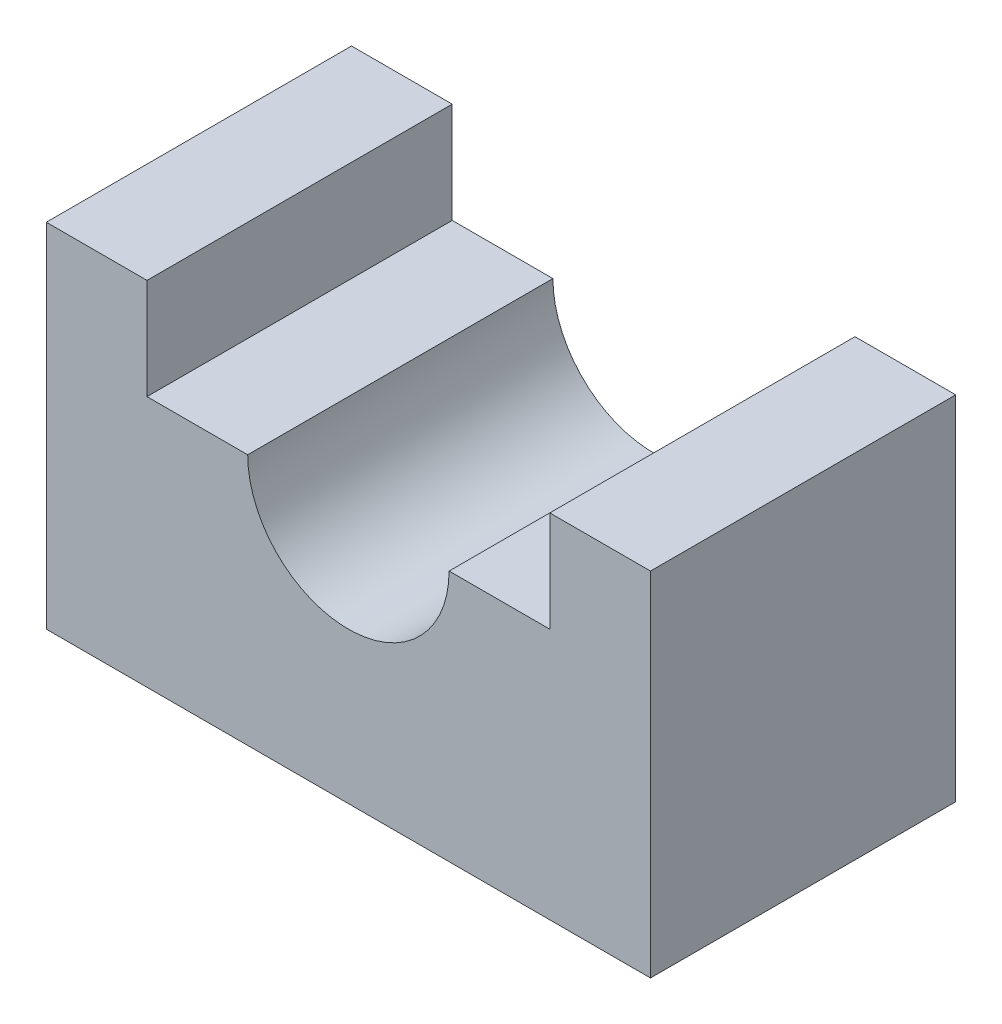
SolidWorks part; units mm, degrees
ref_plane "Front Plane" through (0, 0, 0) normal (0, 0, 1) x (1, 0, 0)
ref_plane "Top Plane" through (0, 0, 0) normal (0, 1, 0) x (1, 0, 0)
ref_plane "Right Plane" through (0, 0, 0) normal (1, 0, 0) x (0, 0, -1)
sketch "Sketch1" plane through (0, 0, 0) normal (0, 0, 1) x (1, 0, 0)
  line L0 (30, 0) -> (90, 0)
  line L1 (90, 0) -> (90, 35)
  line L2 (90, 35) -> (80, 35)
  line L3 (80, 35) -> (80, 25)
  line L4 (80, 25) -> (70, 25)
  line L5 (50, 25) -> (40, 25)
  line L6 (40, 25) -> (40, 35)
  line L7 (40, 35) -> (30, 35)
  line L8 (30, 35) -> (30, 0)
  arc A0 (70, 25) -> (50, 25) centre (60, 25) cw
  dimension "D3" = 10
  dimension "D1" = 60
  dimension "D2" = 35
  dimension "D4" = 10
  dimension "D5" = 10
  dimension "D6" = 30
  dimension "D7" = 10
extrude "Extrude1" add sketch "Sketch1" along normal mid plane 30.31
